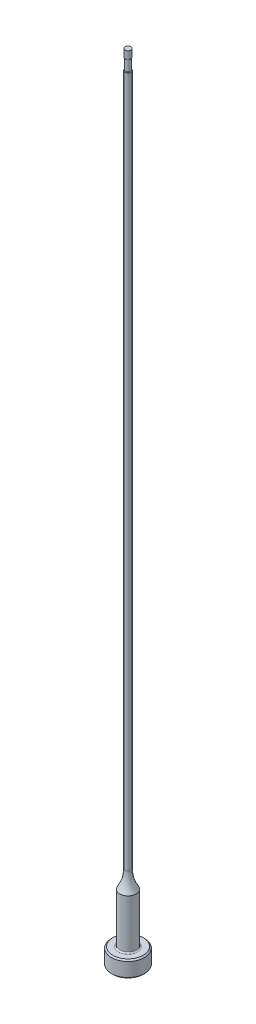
SolidWorks part; units mm, degrees
ref_plane "Front Plane" through (0, 0, 0) normal (0, 0, 1) x (1, 0, 0)
ref_plane "Top Plane" through (0, 0, 0) normal (0, 1, 0) x (1, 0, 0)
ref_plane "Right Plane" through (0, 0, 0) normal (1, 0, 0) x (0, 0, -1)
other "Configuration Table"
sketch "Sketch1" plane through (0, 0, 0) normal (0, 0, 1) x (1, 0, 0)
  line L0 (0, 259.9588) -> (0, -15.1925) construction
  line L1 (0, 0) -> (-3.175, 0)
  line L2 (-3.175, 0) -> (-3.175, 3.175)
  line L3 (-3.175, 3.175) -> (-1.5875, 3.175)
  line L4 (-0.5944, 16.1098) -> (-0.5944, 152.4)
  line L5 (-0.5944, 152.4) -> (0, 152.4)
  line L6 (0, 152.4) -> (0, 0)
  line L7 (-1.5875, 3.175) -> (-1.5875, 12.7)
  arc A1 (-1.5875, 12.7) -> (-0.5944, 16.1098) centre (-6.9444, 16.1098) ccw
  dimension "D1" = 6.35
  dimension "L" = 152.4
  dimension "D2" = 3.175
  dimension "H" = 6.35
  dimension "T" = 3.175
  dimension "D" = 1.1887
  dimension "S" = 12.7
revolve "Revolve1" add sketch "Sketch1" angle 360 about L0
chamfer "Chamfer1" distance 0.254 angle 45 2 edges at (0, 3.175, 3.175) (0, 0, 3.175)
fillet "Fillet1" radius 0.254 1 edges at (0, 3.175, 1.5875)
sketch "Sketch2" plane through (0, 0, 0) normal (0, 0, 1) x (1, 0, 0)
  line L0 (-0.5944, 152.4) -> (-0.5944, 16.1098) construction
  line L1 (-0.5944, 150.876) -> (-0.4928, 150.876)
  line L2 (-0.5944, 150.876) -> (-0.5944, 148.844)
  line L3 (-0.5944, 148.844) -> (-0.4928, 148.844)
  line L4 (-0.4928, 150.876) -> (-0.4928, 148.844)
  line L5 (0.5944, 152.4) -> (-0.5944, 152.4) construction
  line L6 (0, 153.4483) -> (0, 147.3282) construction
  dimension "D1" = 2.032
  dimension "N" = 1.524
  dimension "FD" = 0.1016
  dimension "D3" = 0.9855
revolve "Vent Relief" cut sketch "Sketch2" angle 360 about L6
sketch "Sketch3" plane through (0, 0, 0) normal (0, 0, 1) x (1, 0, 0)
  line L0 (-0.4928, 149.86) -> (-0.4928, 111.76)
  line L1 (-0.4928, 150.876) -> (-0.4928, 148.844) construction
  line L2 (-0.5944, 148.844) -> (-0.5944, 16.1098) construction
  line L3 (-0.5944, 110.9632) -> (-0.5944, 149.86)
  line L4 (-0.5944, 149.86) -> (-0.4928, 149.86)
  arc A0 (-0.4928, 111.76) -> (-0.5944, 110.9632) centre (-3.6678, 111.76) cw
  dimension "D1" = 3.175
  dimension "D2" = 38.1
extrude "D-Slot" cut sketch "Sketch3" against normal through all both and the other way through all
sketch "Sketch5" plane through (0, 0, 0) normal (0, 0, 1) x (1, 0, 0)
  line L0 (-0.5944, 150.876) -> (0.5944, 150.876) construction
  line L1 (-0.5944, 152.4) -> (-0.569, 152.4)
  line L2 (-0.5944, 152.4) -> (-0.5944, 150.876)
  line L3 (-0.5944, 150.876) -> (-0.569, 150.876)
  line L4 (-0.569, 152.4) -> (-0.569, 150.876)
  line L5 (0, 152.6877) -> (0, 150.5771) construction
  dimension "VP" = 0.0254
revolve "Vent Diameter" cut sketch "Sketch5" angle 360 about L5
fillet "Fillet2" radius 0.127 2 edges at (0.5944, 148.844, 0) (0, 150.876, 0.569)
sketch "Pocket Sketch" plane through (0, 0, 0) normal (0, 0, 1) x (1, 0, 0)
  line L0 (-3.5719, 0) -> (-3.5719, 3.2004)
  line L1 (-3.5719, 3.2004) -> (-1.5548, 3.2004)
  line L2 (-0.7928, 3.9624) -> (-0.7928, 22.225)
  line L3 (-0.7928, 22.225) -> (0, 22.225)
  line L4 (0, 22.225) -> (0, 0)
  line L5 (0, 0) -> (-3.5719, 0)
  line L6 (0, 12.6104) -> (0, -2.4989) construction
  line L7 (-3.175, 2.921) -> (-3.175, 0.254) construction
  line L8 (2.921, 3.175) -> (-2.921, 3.175) construction
  line L9 (-0.5944, 110.9632) -> (-0.5944, 16.1098) construction
  line L10 (-1.5548, 3.2004) -> (-0.7928, 3.9624)
  point P3 (-0.7928, 3.2004)
  dimension "D1" = 7.1437
  dimension "D2" = 0.3969
  dimension "D3" = 0.0254
  dimension "D4" = 0.1984
  dimension "D5" = 1.5856
  dimension "D6" = 22.225
